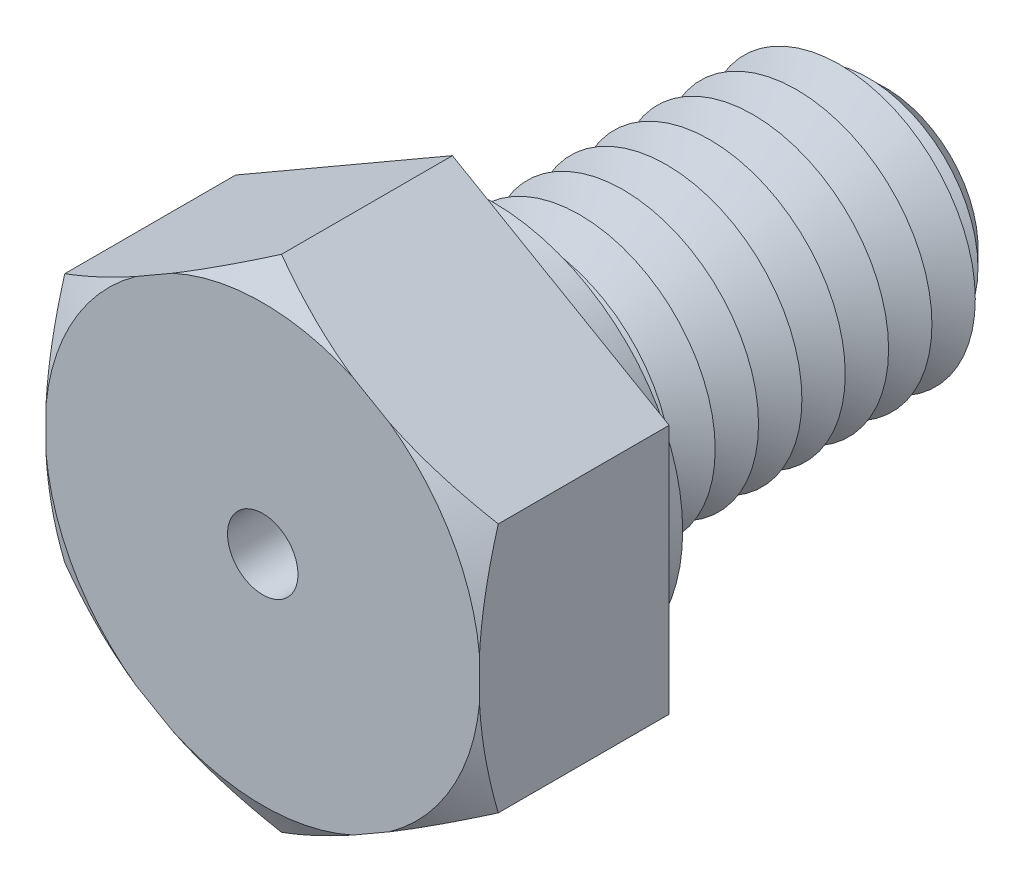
SolidWorks part; units mm, degrees
ref_plane "Front Plane" through (0, 0, 0) normal (0, 0, 1) x (1, 0, 0)
ref_plane "Top Plane" through (0, 0, 0) normal (0, 1, 0) x (1, 0, 0)
ref_plane "Right Plane" through (0, 0, 0) normal (1, 0, 0) x (0, 0, -1)
sketch "Sketch2" plane through (0, 0, 0) normal (0, 0, 1) x (1, 0, 0)
  line L1 (0, 4.6188) -> (-4, 2.3094)
  line L2 (-4, 2.3094) -> (-4, -2.3094)
  line L3 (-4, -2.3094) -> (0, -4.6188)
  line L4 (0, -4.6188) -> (4, -2.3094)
  line L5 (4, -2.3094) -> (4, 2.3094)
  line L6 (4, 2.3094) -> (0, 4.6188)
  circle A0 centre (0, 0) radius 4 construction
  dimension "D1" = 8
extrude "Boss-Extrude1" add sketch "Sketch2" along normal blind 3.5
sketch "Sketch3" plane through (0, 0, 0) normal (0, 0, -1) x (-1, 0, 0)
  circle A0 centre (0, 0) radius 2.5
  dimension "D1" = 5
extrude "Boss-Extrude2" add sketch "Sketch3" along normal blind 8
sketch "Sketch4" plane through (0, 0, 0) normal (0, 0, -1) x (-1, 0, 0)
  circle A0 centre (0, 0) radius 3.5
  dimension "D1" = 7
extrude "Boss-Extrude3" add sketch "Sketch4" along normal blind 0.75
sketch "Sketch5" plane through (0, 0, 0) normal (1, 0, 0) x (0, 0, -1)
  line L0 (-3.2117, 0) -> (6.3192, 0) construction
chamfer "Chamfer1" distance 0.8 angle 45 1 edges at (-2.5, 0, -8)
sketch "Sketch6" plane through (0, 0, 0) normal (1, 0, 0) x (0, 0, -1)
  line L0 (0.75, 2.5) -> (1.15, 1.8072)
  line L1 (1.15, 1.8072) -> (1.55, 2.5)
  line L2 (7.2, 2.5) -> (0.75, 2.5) construction
  line L3 (1.55, 2.5) -> (0.75, 2.5)
  dimension "D1" = 0.8
revolve "Cut-Revolve1" cut sketch "Sketch6" angle 360 about L0
pattern_linear "LPattern1" count 9 spacing 0.8 along (0, 0, -1) of "Cut-Revolve1"
sketch "Sketch7" plane through (0, 0, 0) normal (1, 0, 0) x (0, 0, -1)
  line L0 (-3.5, 4.6188) -> (-3.5, 4.0188)
  line L1 (-3.5, 2.3094) -> (-3.5, 4.6188) construction
  line L2 (-3.5, 4.0188) -> (-3.1536, 4.6188)
  line L3 (-3.5, 4.6188) -> (0, 4.6188) construction
  line L4 (-3.1536, 4.6188) -> (-3.5, 4.6188)
  dimension "D1" = 0.6
  dimension "D2" = 30
revolve "Cut-Revolve2" cut sketch "Sketch7" angle 360 about L0
sketch "Sketch8" plane through (0, 0, 3.5) normal (0, 0, 1) x (1, 0, 0)
  circle A0 centre (0, 0) radius 0.65
  dimension "D1" = 1.3
extrude "Cut-Extrude1" cut sketch "Sketch8" against normal up to surface (11.5 mm away)
